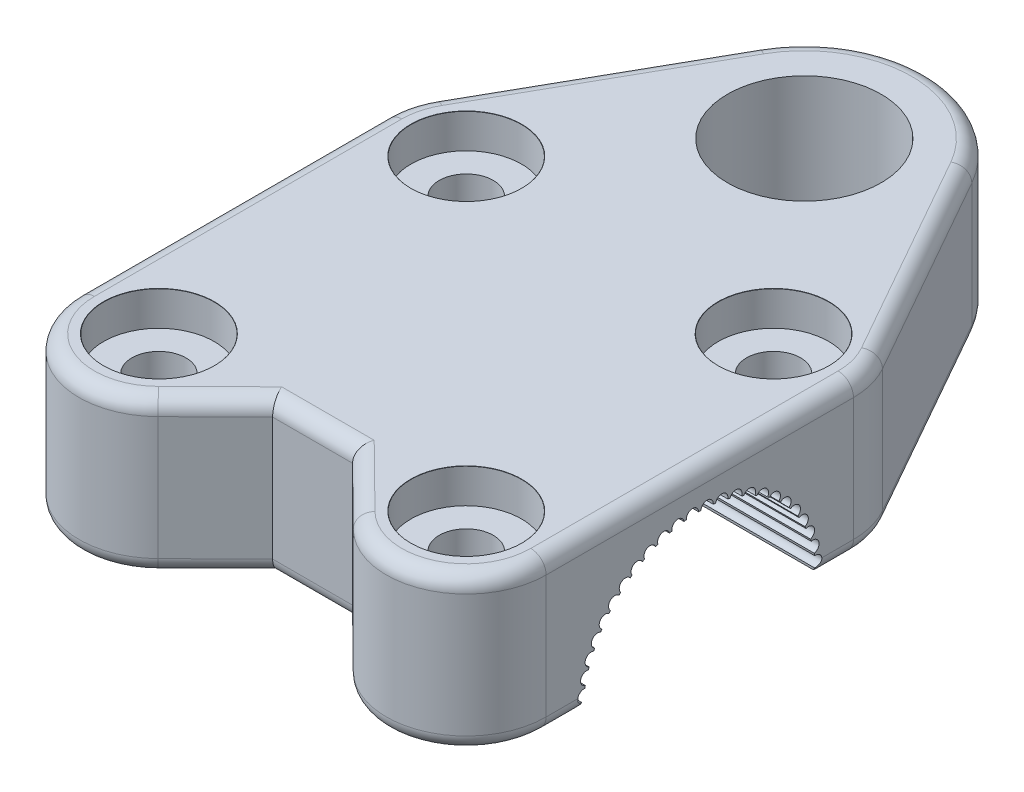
SolidWorks part; units mm, degrees
ref_plane "Front Plane" through (0, 0, 0) normal (0, 0, 1) x (1, 0, 0)
ref_plane "Top Plane" through (0, 0, 0) normal (0, 1, 0) x (1, 0, 0)
ref_plane "Right Plane" through (0, 0, 0) normal (1, 0, 0) x (0, 0, -1)
sketch "Sketch1" plane through (0, 0, 0) normal (0, 1, 0) x (1, 0, 0)
  line L0 (0, 0) -> (0, 83.2805) construction
  line L10 (-6.5, 0) -> (6.5, 0)
  line L11 (6.5, 0) -> (15.8649, -9.2493)
  line L12 (38, 0) -> (38, 50)
  line L13 (36.3169, 56.3974) -> (17.4107, 89.8422)
  line L14 (-36.3169, 56.3974) -> (-17.4107, 89.8422)
  line L15 (-38, 0) -> (-38, 50)
  line L16 (-6.5, 0) -> (-15.8649, -9.2493)
  arc A7 (15.8649, -9.2493) -> (38, 0) centre (25, 0) ccw
  arc A8 (38, 50) -> (36.3169, 56.3974) centre (25, 50) ccw
  arc A9 (-38, 50) -> (-36.3169, 56.3974) centre (-25, 50) cw
  arc A10 (-15.8649, -9.2493) -> (-38, 0) centre (-25, 0) cw
  arc A11 (17.4107, 89.8422) -> (-17.4107, 89.8422) centre (0, 80) ccw
  point P6 (0, 0)
  dimension "D1" = 13
  dimension "D4" = 80
  dimension "D5" = 13
  dimension "D7" = 20
  dimension "D2" = 13
  dimension "D3" = 50
  dimension "D6" = 50
extrude "Boss-Extrude1" add sketch "Sketch1" along normal blind 25
hole_wizard "CBORE for M8 Hex Head Bolt1" positions "Sketch2" profile "Sketch3" counterbore size "M8" standard "ANSI Metric"
sketch "Sketch2" plane through (0, 25, 0) normal (0, 1, 0) x (1, 0, 0)
  arc A1 (-38, 0) -> (-15.8649, -9.2493) centre (-25, 0) ccw construction
  point P0 (-25, 0)
  point P3 (0, 0)
  point P7 (0, 0)
sketch "Sketch3" plane through (-25, 25, 0) normal (1, 0, 0) x (0, 0, 1)
  line L0 (0, 0) -> (0, 25)
  line L1 (0, 25) -> (4.4, 25)
  line L3 (4.4, 25) -> (4.4, 5.6)
  line L4 (9, 5.6) -> (4.4, 5.6)
  line L5 (9, 5.6) -> (9, 0.03)
  line L6 (9, 0.03) -> (9.03, 0)
  line L7 (9.03, 0) -> (0, 0)
  line L8 (-9, 0.03) -> (-9.03, 0) construction
  line L11 (0, -6.35) -> (0, 107.95) construction
  dimension "Thru Hole Dia." = 8.8
  dimension "Thru Hole Depth" = 25
  dimension "C'Bore Dia." = 18
  dimension "C'Bore Depth" = 5.6
  dimension "Near C'Sink Dia." = 18.06
  dimension "Near C'Sink Angle" = 90
pattern_linear "LPattern1" count 2 spacing 50 along (1, 0, 0) count 2 spacing 50 along (0, 0, -1) of "CBORE for M8 Hex Head Bolt1"
sketch "Sketch4" plane through (0, 25, 0) normal (0, 1, 0) x (1, 0, 0)
  circle A0 centre (0, 80) radius 12.5
  arc A1 (17.4107, 89.8422) -> (-17.4107, 89.8422) centre (0, 80) ccw construction
  dimension "D1" = 25
extrude "Cut-Extrude1" cut sketch "Sketch4" against normal through all
sketch "Sketch5" plane through (38, 0, 0) normal (1, 0, 0) x (0, 0, -1)
  line L0 (0, 0) -> (50, 0) construction
  line L1 (-13, 25) -> (-13, 0) construction
  circle A0 centre (25, 0) radius 19
  dimension "D1" = 38
  dimension "D2" = 38
extrude "Cut-Extrude2" cut sketch "Sketch5" against normal through all
sketch "Sketch6" plane through (38, 0, 0) normal (1, 0, 0) x (0, 0, -1)
  circle A0 centre (44, 0) radius 1
  dimension "D1" = 2
extrude "Cut-Extrude3" cut sketch "Sketch6" against normal through all
pattern_circular "CirPattern1" count 26 over 180 about axis through (0, 0, -25) along (1, 0, 0) of "Cut-Extrude3"
fillet "Fillet1" radius 2.5 26 edges at (-38, 0, -47.5) (-37.5722, 0, -53.3076) (-26.8638, 0, -73.1198) (0, 0, -100) (26.8638, 0, -73.1198) (37.5722, 0, -53.3076) (11.1824, 0, 4.6246) (38, 0, -2.5) (-38, 0, -2.5) (-11.1824, 0, 4.6246) (11.1824, 25, 4.6246) (30.0121, 25, 11.9949) (38, 25, -25) (37.5722, 25, -53.3076) (26.8638, 25, -73.1198) (0, 25, -100) (-26.8638, 25, -73.1198) (-37.5722, 25, -53.3076) (-38, 25, -25) (-11.1824, 25, 4.6246) (38, 0, -47.5) (0, 0, 0) (30.0121, 0, 11.9949) (-30.0121, 0, 11.9949) (0, 25, 0) (-30.0121, 25, 11.9949)
